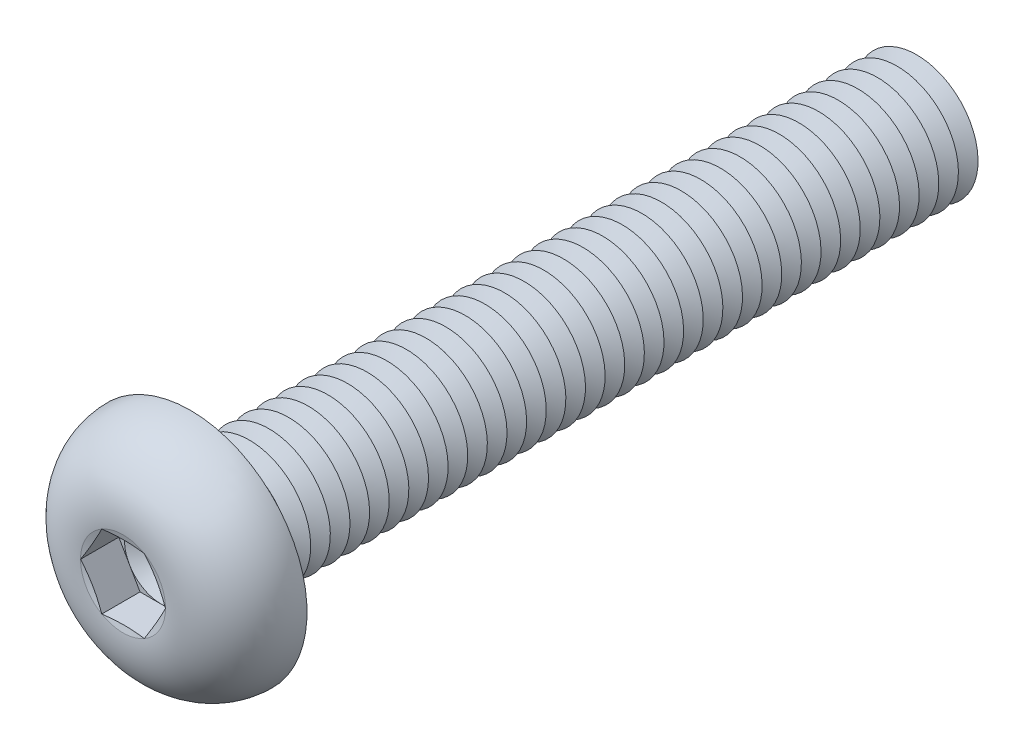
SolidWorks part; units mm, degrees
ref_plane "Front Plane" through (0, 0, 0) normal (0, 0, 1) x (1, 0, 0)
ref_plane "Top Plane" through (0, 0, 0) normal (0, 1, 0) x (1, 0, 0)
ref_plane "Right Plane" through (0, 0, 0) normal (1, 0, 0) x (0, 0, -1)
sketch "Sketch1" plane through (0, 0, 0) normal (1, 0, 0) x (0, 0, -1)
  line L0 (0, 2.5) -> (0, 4.75)
  line L3 (0, 2.5) -> (30, 2.5)
  line L4 (30, 2.5) -> (30, 0)
  line L5 (30, 0) -> (-2.75, 0) construction
  line L6 (-2.75, 0) -> (30, 0)
  line L7 (-2.75, 1.732) -> (-2.75, 0.866) construction
  line L8 (-2.75, 0.866) -> (-2.75, 0)
  line L9 (-2.75, 1.732) -> (-2.5179, 0.866)
  line L10 (-2.5179, 0.866) -> (-2.75, 0.866)
  line L11 (30, 0) -> (22.7481, 0) construction
  line L12 (0, 4.75) -> (-2.75, 4.75) construction
  arc A1 (0, 4.75) -> (-2.75, 1.732) centre (0, 1.9881) ccw
  point P8 (30, 1.25)
  dimension "D1" = 9.5
  dimension "D2" = 5
  dimension "D3" = 2.75
  dimension "D4" = 3.4641
  dimension "D5" = 30
  dimension "D6" = 15
revolve "Revolve1" add sketch "Sketch1" angle 360 about L5
fillet "Fillet1" radius 0.4 1 edges at (0, 2.5, 0)
sketch "Sketch2" plane through (0, 0, 0) normal (1, 0, 0) x (0, 0, -1)
  line L0 (29.6, 2.5) -> (30.4, 2.5)
  line L1 (30, 2.5) -> (0.4, 2.5) construction
  line L2 (30.4, 2.5) -> (30, 1.8072)
  line L3 (30, -2.5) -> (30, 2.5) construction
  line L4 (30, 1.8072) -> (29.6, 2.5)
  dimension "D1" = 0.8
revolve "Cut-Revolve1" cut sketch "Sketch2" angle 360 about axis through (0, 0, -30) along (0, 0, -1)
pattern_linear "LPattern1" count 37 spacing 0.8 along (0, 0, 1) of "Cut-Revolve1"
sketch "Sketch3" plane through (0, 0, 2.75) normal (0, 0, 1) x (1, 0, 0)
  line L7 (0.866, 1.5) -> (-0.866, 1.5)
  line L8 (-0.866, 1.5) -> (-1.7321, 0)
  line L9 (-1.7321, 0) -> (-0.866, -1.5)
  line L10 (-0.866, -1.5) -> (0.866, -1.5)
  line L11 (0.866, -1.5) -> (1.7321, 0)
  line L12 (1.7321, 0) -> (0.866, 1.5)
  circle A0 centre (0, 0) radius 1.5 construction
  circle A3 centre (0, 0) radius 1.732 construction
extrude "Cut-Extrude1" cut sketch "Sketch3" against normal blind 1.56
sketch "Sketch4" plane through (0, 0, 1.19) normal (0, 0, 1) x (1, 0, 0)
  line L1 (0.866, 1.5) -> (-0.866, 1.5) construction
  circle A0 centre (0, 0) radius 1.5
extrude "Cut-Extrude2" cut sketch "Sketch4" against normal through all draft 60
